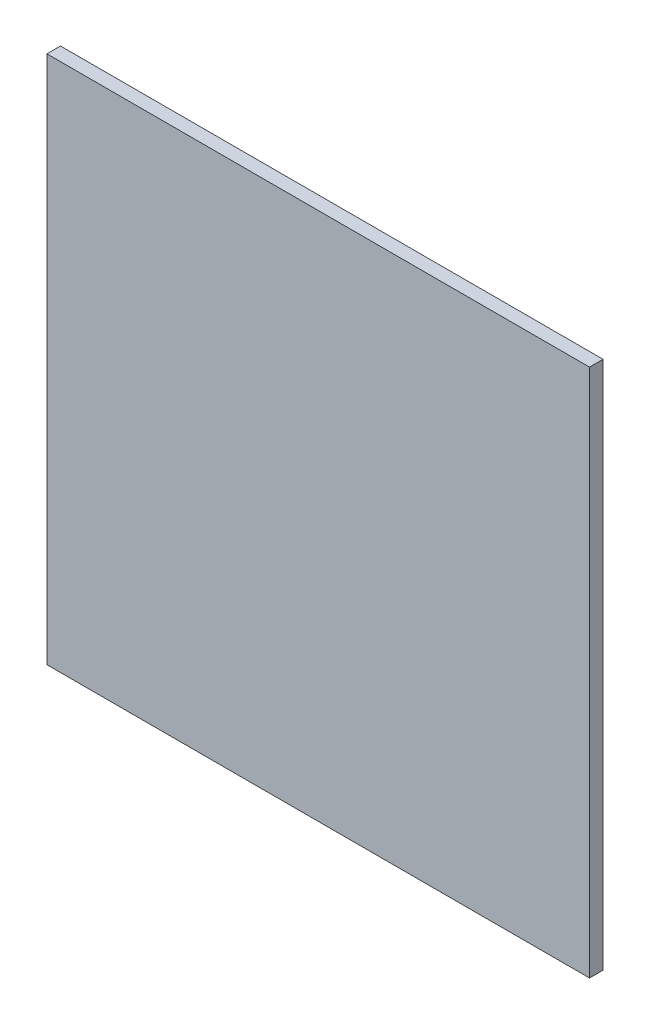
SolidWorks part; units mm, degrees
ref_plane "Alzado" through (0, 0, 0) normal (0, 0, 1) x (1, 0, 0)
ref_plane "Planta" through (0, 0, 0) normal (0, 1, 0) x (1, 0, 0)
ref_plane "Vista lateral" through (0, 0, 0) normal (1, 0, 0) x (0, 0, -1)
sketch "Croquis1" plane through (0, 0, 0) normal (0, 0, 1) x (1, 0, 0)
  line L1 (-300, 292.5) -> (300, 292.5)
  line L2 (-300, 292.5) -> (-300, -292.5)
  line L3 (-300, -292.5) -> (300, -292.5)
  line L4 (300, 292.5) -> (300, -292.5)
  line L5 (-300, 292.5) -> (300, -292.5) construction
  line L6 (-300, -292.5) -> (300, 292.5) construction
  point P0 (0, 0)
  dimension "D1" = 600
  dimension "D2" = 585
extrude "Saliente-Extruir1" add sketch "Croquis1" along normal blind 15
